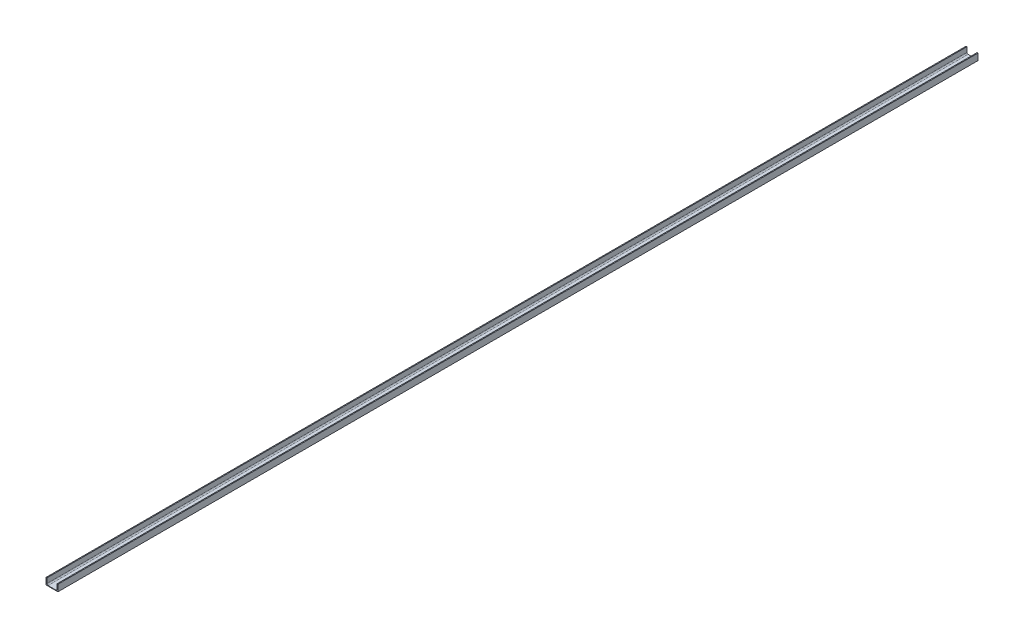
SolidWorks part; units mm, degrees
ref_plane "Plan de face" through (0, 0, 0) normal (0, 0, 1) x (1, 0, 0)
ref_plane "Plan de dessus" through (0, 0, 0) normal (0, 1, 0) x (1, 0, 0)
ref_plane "Plan de droite" through (0, 0, 0) normal (1, 0, 0) x (0, 0, -1)
sketch "Esquisse1" plane through (0, 0, 0) normal (0, 0, 1) x (1, 0, 0)
  line L0 (0, 0) -> (100, 0)
  line L1 (100, 0) -> (100, 55)
  line L2 (100, 55) -> (92.5, 55)
  line L3 (92.5, 55) -> (92.5, 14.5)
  line L4 (82.5, 4.5) -> (17.5, 4.5)
  line L5 (7.5, 14.5) -> (7.5, 55)
  line L6 (0, 0) -> (0, 55)
  line L7 (0, 55) -> (7.5, 55)
  arc A0 (17.5, 4.5) -> (7.5, 14.5) centre (17.5, 14.5) cw
  arc A1 (92.5, 14.5) -> (82.5, 4.5) centre (82.5, 14.5) cw
  dimension "D7" = 10
  dimension "D1" = 100
  dimension "D2" = 55
  dimension "D3" = 7.5
  dimension "D4" = 7.5
  dimension "D5" = 4.5
  dimension "D6" = 55
extrude "Extrusion1" add sketch "Esquisse1" along normal blind 7710 contours L1 L2 L3 A1 L4 A0 L5 L7 L6 L0
sketch "Esquisse2" plane through (0, 0, 0) normal (0, -1, 0) x (1, 0, 0)
  line L0 (0, 7710) -> (0, 0) construction
  line L1 (0, 0) -> (100, 0) construction
  circle A0 centre (70, 150) radius 7.5
  circle A1 centre (70, 540) radius 7.5
  circle A2 centre (70, 930) radius 7.5
  circle A3 centre (70, 1320) radius 7.5
  circle A4 centre (70, 1710) radius 7.5
  circle A5 centre (70, 2100) radius 7.5
  circle A6 centre (70, 2490) radius 7.5
  circle A7 centre (70, 2880) radius 7.5
  circle A8 centre (70, 3270) radius 7.5
  circle A9 centre (70, 3660) radius 7.5
  circle A10 centre (70, 4050) radius 7.5
  circle A11 centre (70, 4440) radius 7.5
  circle A12 centre (70, 4830) radius 7.5
  circle A13 centre (70, 5220) radius 7.5
  circle A14 centre (70, 5610) radius 7.5
  circle A15 centre (70, 6000) radius 7.5
  circle A16 centre (70, 6390) radius 7.5
  circle A17 centre (70, 6780) radius 7.5
  circle A18 centre (70, 7170) radius 7.5
  circle A19 centre (70, 7560) radius 7.5
  dimension "D1" = 15
  dimension "D2" = 70
  dimension "D3" = 150
extrude "Enlèv. mat.-Extru.1" cut sketch "Esquisse2" against normal blind 10
